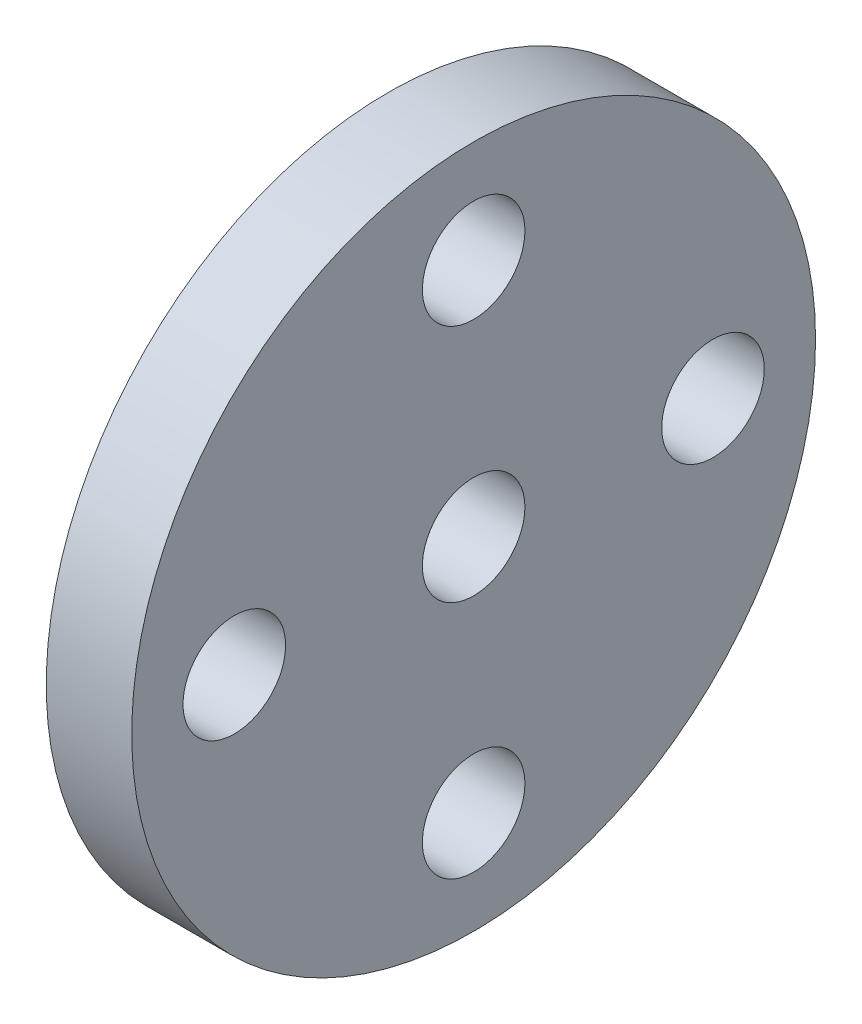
SolidWorks part; units mm, degrees
ref_plane "前视基准面" through (0, 0, 0) normal (0, 0, 1) x (1, 0, 0)
ref_plane "上视基准面" through (0, 0, 0) normal (0, 1, 0) x (1, 0, 0)
ref_plane "右视基准面" through (0, 0, 0) normal (1, 0, 0) x (0, 0, -1)
sketch "草图4" plane through (0, 0, 0) normal (1, 0, 0) x (0, 0, -1)
  circle A1 centre (0, 0) radius 10
  circle A3 centre (0.0007, 7) radius 1.5
  circle A4 centre (-7, 0) radius 1.5
  circle A5 centre (0, 0) radius 1.5
  circle A6 centre (0, -7) radius 1.5
  circle A7 centre (7, 0) radius 1.5
  point P6 (0, 0)
  point P10 (0, 0)
  point P13 (0, 0)
extrude "凸台-拉伸2" add sketch "草图4" along normal blind 2.5
sketch "草图12" plane through (0, 0, 0) normal (1, 0, 0) x (0, 0, -1)
  circle A0 centre (0, 0) radius 3
  circle A1 centre (0, 0) radius 4.5
extrude "凸台-拉伸5" add sketch "草图12" against normal blind 1.5
